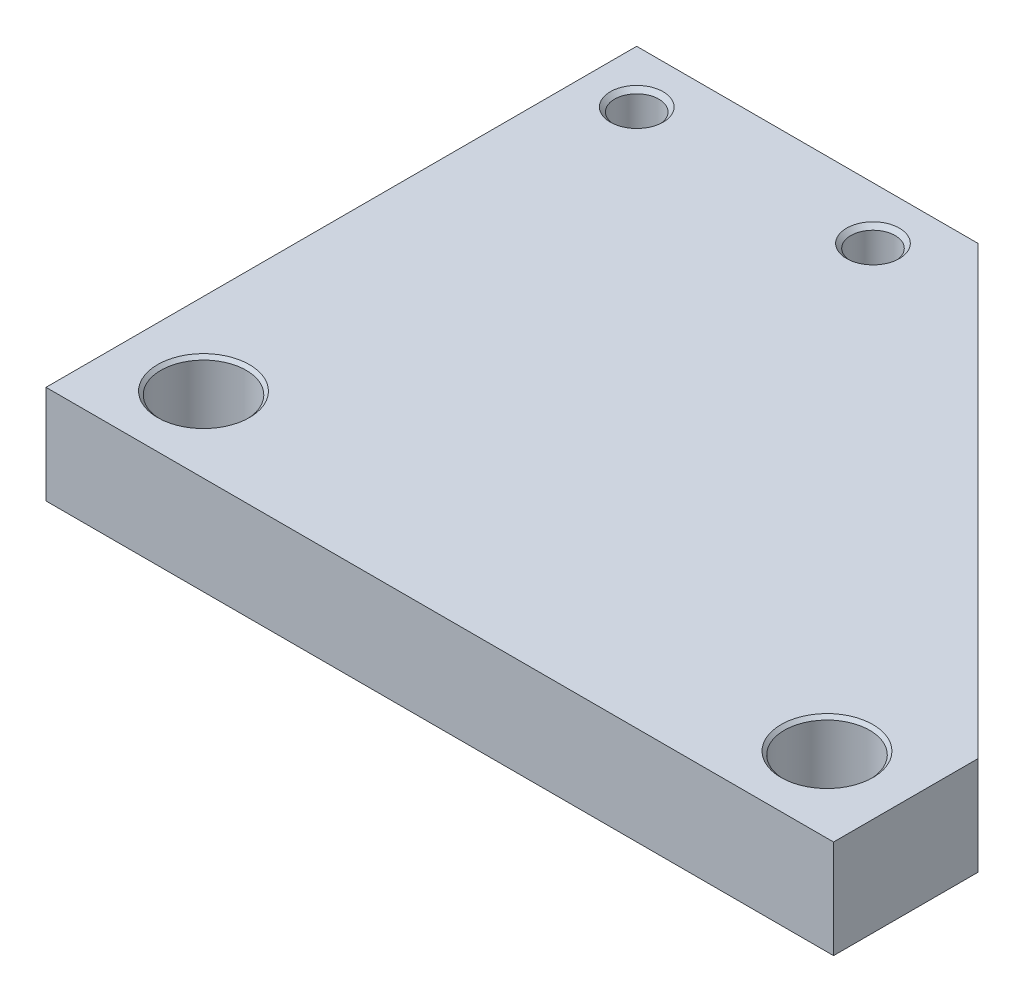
SolidWorks part; units mm, degrees
ref_plane "Спереди" through (0, 0, 0) normal (0, 0, 1) x (1, 0, 0)
ref_plane "Сверху" through (0, 0, 0) normal (0, 1, 0) x (1, 0, 0)
ref_plane "Справа" through (0, 0, 0) normal (1, 0, 0) x (0, 0, -1)
sketch "Эскиз1" plane through (0, 0, 0) normal (0, 1, 0) x (1, 0, 0)
  line L0 (-111.99, -8) -> (-75.99, -8) construction
  line L1 (-67.99, 0) -> (-119.99, 0)
  line L2 (0, -67.99) -> (0, -90)
  line L3 (0, -90) -> (-120, -90)
  line L4 (-120, -0.01) -> (-120, -90)
  line L5 (-107.5, -78.5) -> (-12.5, -78.5) construction
  line L6 (-120, -0.01) -> (-119.99, 0)
  line L7 (-93.99, -8) -> (-60, -78.5) construction
  line L8 (-67.99, 0) -> (0, -67.99)
  circle A0 centre (-60, -78.995) radius 61.0009 construction
  dimension "D7" = 122.0018
  dimension "D2" = 120
  dimension "D3" = 95
  dimension "D4" = 36
  dimension "D5" = 8
  dimension "D6" = 70.5
  dimension "D8" = 12.5
  dimension "D9" = 8
  dimension "D10" = 26.01
  dimension "D11" = 45
  dimension "D12" = 8
  dimension "D13" = 90
  dimension "D14" = 33.99
extrude "Бобышка-Вытянуть1" add sketch "Эскиз1" along normal blind 15
hole_wizard "Отверстие обработанное метчиком 1" positions "Эскиз5" profile "Эскиз4" tap size "M8" standard "GOST"
sketch "Эскиз5" plane through (0, 15, 0) normal (0, 1, 0) x (1, 0, 0)
  point P0 (-111.99, -8)
  point P3 (-75.99, -8)
sketch "Эскиз4" plane through (-111.99, 15, 8) normal (1, 0, 0) x (0, 0, 1)
  line L0 (0, 0) -> (0, 15)
  line L1 (0, 15) -> (4.025, 15)
  line L2 (3.375, 14.35) -> (3.375, 0.65)
  line L3 (3.375, 0.65) -> (4.025, 0)
  line L5 (4.025, 0) -> (0, 0)
  line L6 (-3.375, 0.65) -> (-4.025, 0) construction
  line L7 (4.025, 15) -> (3.375, 14.35)
  line L8 (-4.025, 15) -> (-3.375, 14.35) construction
  line L11 (0, -6.35) -> (0, 107.95) construction
  dimension "Диаметр проходного сверла" = 6.75
  dimension "Глубина проходного сверла" = 15
  dimension "Диаметр передней зенковки" = 8.05
  dimension "Угол передней зенковки" = 90
  dimension "Диаметр задней зенковки" = 8.05
  dimension "Угол задней зенковки" = 90
hole_wizard "Диаметр отверстия Ø13.0 (13)1" positions "Эскиз7" profile "Эскиз6" hole size "Ø13.0" standard "GOST"
sketch "Эскиз7" plane through (0, 15, 0) normal (0, 1, 0) x (1, 0, 0)
  point P0 (-107.5, -78.5)
  point P3 (-12.5, -78.5)
sketch "Эскиз6" plane through (-107.5, 15, 78.5) normal (1, 0, 0) x (0, 0, 1)
  line L0 (0, 0) -> (0, 15)
  line L1 (0, 15) -> (7, 15)
  line L2 (6.5, 14.5) -> (6.5, 0.5)
  line L3 (6.5, 0.5) -> (7, 0)
  line L5 (7, 0) -> (0, 0)
  line L6 (-6.5, 0.5) -> (-7, 0) construction
  line L7 (7, 15) -> (6.5, 14.5)
  line L8 (-7, 15) -> (-6.5, 14.5) construction
  line L11 (0, -6.35) -> (0, 107.95) construction
  dimension "Диаметр сквозного отверстия" = 13
  dimension "Глубина сквозного отверстия" = 15
  dimension "Диаметр передней зенковки" = 14
  dimension "Угол передней зенковки" = 90
  dimension "Диаметр задней зенковки" = 14
  dimension "Угол задней зенковки" = 90
